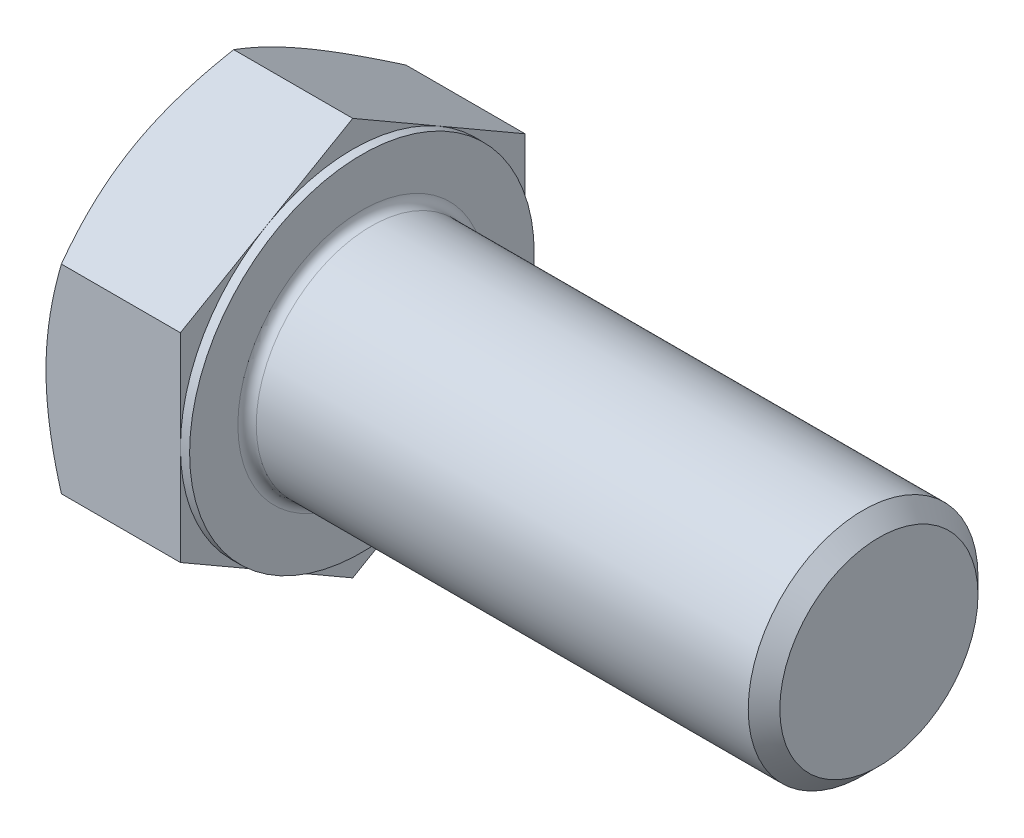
SolidWorks part; units mm, degrees
ref_plane "Plane1" through (0, 0, 0) normal (0, 0, 1) x (1, 0, 0)
ref_plane "Plane2" through (0, 0, 0) normal (0, 1, 0) x (1, 0, 0)
ref_plane "Plane3" through (0, 0, 0) normal (1, 0, 0) x (0, 0, -1)
extrude "BaseHead" add sketch "Sketch1" along normal blind 12.5
sketch "Sketch1" plane through (0, 0, 0) normal (1, 0, 0) x (0, 0, -1)
  line L0 (15, 8.6603) -> (15, -8.6603)
  line L1 (-15, 8.6603) -> (-15, -8.6603)
  line L2 (15, -8.6603) -> (0, -17.3205)
  line L3 (0, -17.3205) -> (-15, -8.6603)
  line L4 (15, 8.6603) -> (0, 17.3205)
  line L5 (0, 17.3205) -> (-15, 8.6603)
  dimension "Width_flats" = 30
  dimension "D2" = 120
  dimension "D3" = 15
  dimension "D4" = 15
  dimension "D5" = 15
revolve "BearingFace" cut sketch "Sketch4"
sketch "Sketch4"
  line L1 (12.5, 17.3205) -> (12.5, 8.6603) construction
  line L2 (12.5, 15) -> (11.7, 15)
  line L3 (12.5, 15) -> (12.5, 27.3205)
  line L4 (12.5, 27.3205) -> (11.7, 27.3205)
  line L5 (0, 0) -> (95.25, 0) construction
  line L6 (0, 0) -> (96.52, 0) construction
  line L7 (11.7, 15) -> (11.7, 27.3205)
  line L8 (12.5, 17.3205) -> (1.3397, 17.3205) construction
revolve "HeadChamfer" cut sketch "Sketch3" angle 360 about L6
sketch "Sketch3" plane through (0, 0, 0) normal (0, 0, 1) x (1, 0, 0)
  line L0 (0, 15) -> (4.2265, 22.3205)
  line L1 (0, 17.3205) -> (0, 8.6603) construction
  line L2 (4.2265, 22.3205) -> (4.2265, 27.3205)
  line L3 (4.2265, 27.3205) -> (-10, 27.3205)
  line L4 (-10, 27.3205) -> (-10, 15)
  line L5 (-10, 15) -> (0, 15)
  line L6 (0, 0) -> (99.06, 0) construction
  line L7 (12.5, 17.3205) -> (0, 17.3205) construction
  dimension "D1" = 15
  dimension "D2" = 5
  dimension "D3" = 10
  dimension "D4" = 5
  dimension "Head_ch_ang" = 30
sketch "BodySke" plane through (0, 0, 0) normal (0, 0, 1) x (1, 0, 0)
  line L0 (0, 8.6603) -> (0, -8.6603) construction
  line L1 (0, 0) -> (57.5, 0)
  line L2 (0, 0) -> (0, 10)
  line L3 (0, 10) -> (56.126, 10)
  line L4 (57.5, 0) -> (57.5, 8.626)
  line L5 (12.5, 17.3205) -> (12.5, 8.6603) construction
  line L6 (57.5, 8.626) -> (56.126, 10)
  line L7 (0, 0) -> (96.52, 0) construction
  line L8 (57.5, -8.626) -> (56.126, -10) construction
  line L9 (0, -10) -> (56.126, -10) construction
  line L10 (15, 15.24) -> (15, -1.27) construction
  line L12 (12.5, 8.6603) -> (12.5, -8.6603) construction
  dimension "Length" = 45
  dimension "Body_ch_ang" = 45
  dimension "Diameter" = 20
  dimension "Minor_dia" = 17.252
  dimension "Advance" = 2.5
revolve "BaseBody" add sketch "BodySke"
fillet "HeadFillet" radius 0.8 1 edges at (12.5, 0, -10)
sketch "ThdSchSke" plane through (0, 0, 0) normal (0, 0, 1) x (1, 0, 0)
  line L0 (15, -8.626) -> (14.0379, -10)
  line L1 (15, -8.626) -> (15.9621, -10)
  line L2 (15.9621, -10) -> (15.9621, -12.5)
  line L3 (-3.175, 0) -> (5.1513, 0) construction
  line L5 (15.9621, -12.5) -> (14.0379, -12.5)
  line L6 (14.0379, -12.5) -> (14.0379, -10)
  dimension "Thread_minor" = 17.252
  dimension "Diameter" = 20
  dimension "Start" = 15
  dimension "SideAngle" = 55
  dimension "VeeAngle" = 70
  dimension "Overcut" = 25
revolve "ThreadSchematic" [suppressed] cut sketch "ThdSchSke" angle 360 about L3
pattern_linear "ThdSchPat" [suppressed]
equation "\"D3@Sketch1\" = \"Width_flats@Sketch1\" / 2"
equation "\"D4@Sketch1\" = \"D3@Sketch1\""
equation "\"D5@Sketch1\" = \"D4@Sketch1\""
equation "\"Thread_minor@ThreadCosmetic\" = \"Minor_dia@BodySke\""
equation "\"D1@Sketch3\" = \"Width_flats@Sketch1\" / 2"
equation "\"D1@Sketch4\" = \"Width_flats@Sketch1\""
equation "\"Thread_length@ThreadCosmetic\" = \"Length@BodySke\" - \"Advance@BodySke\""
equation "\"Thread_minor@ThdSchSke\" = \"Minor_dia@BodySke\""
equation "\"Diameter@ThdSchSke\" = \"Diameter@BodySke\""
equation "\"Overcut@ThdSchSke\" = \"Diameter@BodySke\" * 1.25"
equation "\"Start@ThdSchSke\" = \"Head_ht@BaseHead\" + \"Length@BodySke\" - \"Thread_length@ThreadCosmetic\"  '---Non-countersunk---"
equation "\"Num_threads@ThdSchPat\" = int( \"Thread_length@ThreadCosmetic\" / \"Advance@BodySke\" + 0.999 )  + 1"
equation "\"Advance@ThdSchPat\" = \"Thread_length@ThreadCosmetic\" /  (\"Num_threads@ThdSchPat\" - 1) 'relax it"
equation "\"Num_threads@ThdSchPat\" = \"Num_threads@ThdSchPat\" - sgn( \"Num_threads@ThdSchPat\" - 1) '---chamfered tips only---"
